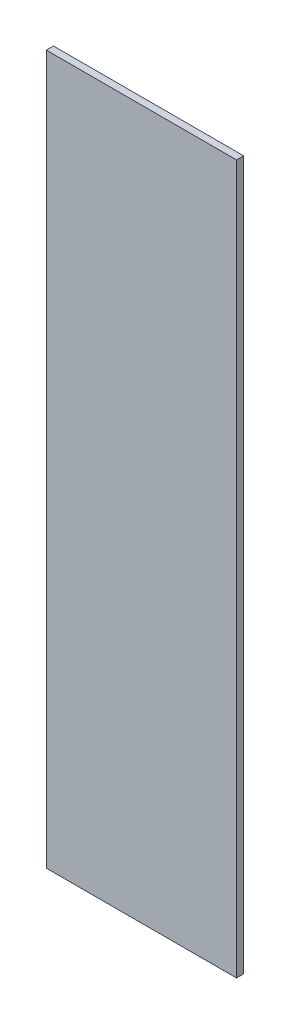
SolidWorks part; units mm, degrees
ref_plane "Alzado" through (0, 0, 0) normal (0, 0, 1) x (1, 0, 0)
ref_plane "Planta" through (0, 0, 0) normal (0, 1, 0) x (1, 0, 0)
ref_plane "Vista lateral" through (0, 0, 0) normal (1, 0, 0) x (0, 0, -1)
sketch "Croquis2" plane through (0, 0, 0) normal (0, 0, 1) x (1, 0, 0)
  line L1 (-200, 745) -> (200, 745)
  line L2 (-200, 745) -> (-200, -745)
  line L3 (-200, -745) -> (200, -745)
  line L4 (200, 745) -> (200, -745)
  line L5 (-200, 745) -> (200, -745) construction
  line L6 (-200, -745) -> (200, 745) construction
  point P0 (0, 0)
  dimension "D1" = 400
  dimension "D2" = 1490
extrude "Saliente-Extruir1" add sketch "Croquis2" along normal blind 15
